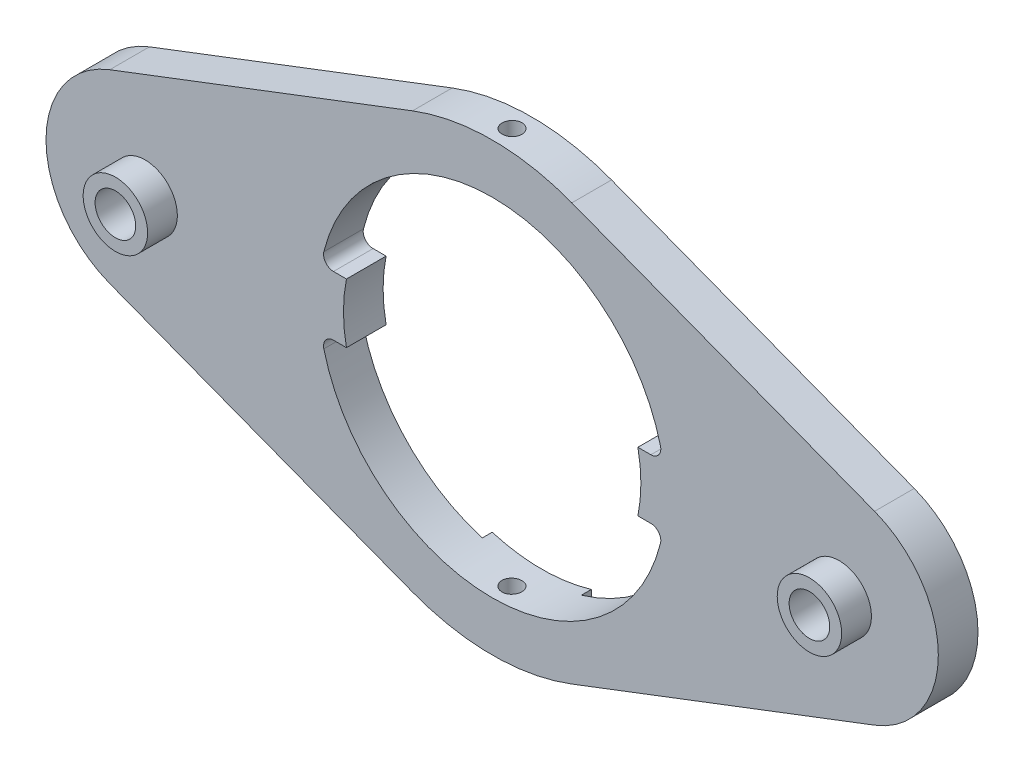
SolidWorks part; units mm, degrees
ref_plane "前视基准面" through (0, 0, 0) normal (0, 0, 1) x (1, 0, 0)
ref_plane "上视基准面" through (0, 0, 0) normal (0, 1, 0) x (1, 0, 0)
ref_plane "右视基准面" through (0, 0, 0) normal (1, 0, 0) x (0, 0, -1)
sketch "草图1" plane through (0, 0, 0) normal (0, 0, 1) x (1, 0, 0)
  line L0 (-8.0357, 21.0161) -> (-38.5714, 9.3405)
  line L1 (0, 0) -> (0, 51.632) construction
  line L2 (-38.5714, -9.3405) -> (-8.0357, -21.0161)
  line L3 (0, 0) -> (-33.8264, 0) construction
  line L4 (38.5714, -9.3405) -> (8.0357, -21.0161)
  line L5 (8.0357, 21.0161) -> (38.5714, 9.3405)
  circle A0 centre (0, 0) radius 17.5
  arc A1 (-8.0357, -21.0161) -> (8.0357, -21.0161) centre (0, 0) ccw
  arc A2 (-38.5714, 9.3405) -> (-38.5714, -9.3405) centre (-35, 0) ccw
  arc A3 (38.5714, 9.3405) -> (38.5714, -9.3405) centre (35, 0) cw
  arc A4 (8.0357, 21.0161) -> (-8.0357, 21.0161) centre (0, 0) ccw
  dimension "D1" = 35
  dimension "D2" = 45
  dimension "D4" = 10
  dimension "D3" = 70
extrude "凸台-拉伸1" add sketch "草图1" along normal mid plane 4
sketch "草图2" plane through (0, 0, 2) normal (0, 0, 1) x (1, 0, 0)
  line L0 (0, 0) -> (0, 12.2881) construction
  circle A0 centre (-35, 0) radius 1.45
  circle A1 centre (35, 0) radius 1.45
  dimension "D1" = 2.9
  dimension "D2" = 70
hole_wizard "M4 螺纹孔1" positions "3D草图1" profile "草图3" tap size "M4" standard "GB"
sketch3d "3D草图1"
  point P0 (-35, 0, 2)
  point P3 (35, 0, 2)
sketch "草图3" plane through (-35, 0, 2) normal (1, 0, 0) x (0, -1, 0)
  line L0 (0, 0) -> (0, 4)
  line L1 (0, 4) -> (1.65, 4)
  line L2 (1.65, 4) -> (1.65, 0)
  line L5 (1.65, 0) -> (0, 0)
  line L11 (0, -6.35) -> (0, 107.95) construction
  dimension "通孔螺纹孔钻头直径" = 3.3
  dimension "通孔螺纹孔钻头深度" = 4
sketch "草图4" plane through (0, 0, 2) normal (0, 0, 1) x (1, 0, 0)
  line L0 (0, 0) -> (-26.4337, 0) construction
sketch "草图5" plane through (0, 0, 2) normal (0, 0, 1) x (1, 0, 0)
  line L0 (14.6969, 3) -> (18, 3)
  line L1 (-18, 3) -> (-14.6969, 3)
  line L2 (-18, 3) -> (-18, -3)
  line L3 (-18, -3) -> (-14.6969, -3)
  line L4 (18, 3) -> (18, -3)
  line L5 (-18, 3) -> (18, -3) construction
  line L6 (-18, -3) -> (18, 3) construction
  line L7 (14.6969, -3) -> (18, -3)
  arc A0 (-14.6969, 3) -> (-14.6969, -3) centre (0, 0) ccw
  arc A1 (14.6969, -3) -> (14.6969, 3) centre (0, 0) ccw
  point P3 (0, 0)
  dimension "D1" = 30
  dimension "D2" = 36
  dimension "D3" = 6
extrude "凸台-拉伸2" add sketch "草图5" against normal blind 4
fillet "圆角1" radius 1 4 edges at (-17.2409, 3, 0) (-17.2409, -3, 0) (17.2409, 3, 0) (17.2409, -3, 0)
ref_plane "基准面1" through (0, 22.5, 0) normal (0, 1, 0) x (1, 0, 0)
sketch "草图6" plane through (0, 22.5, 0) normal (0, 1, 0) x (1, 0, 0)
  circle A0 centre (0, 0) radius 1
  dimension "D1" = 2
ref_plane "基准面4" through (0, -22.5, 0) normal (0, 1, 0) x (1, 0, 0)
extrude "切除-拉伸1" cut sketch "草图6" against normal blind 52
sketch "草图7" plane through (0, 0, 2) normal (0, 0, 1) x (1, 0, 0)
  line L0 (0, 0) -> (0, 30.1855) construction
  circle A0 centre (-35, 0) radius 2.05
  circle A1 centre (-35, 0) radius 3.25
  circle A2 centre (35, 0) radius 2.05
  circle A3 centre (35, 0) radius 3.25
  dimension "D1" = 4.1
  dimension "D2" = 6.5
extrude "凸台-拉伸3" add sketch "草图7" along normal blind 3
sketch "草图8" plane through (0, 0, -2) normal (0, 0, -1) x (-1, 0, 0)
  line L0 (0, 17.5) -> (0, 19.5) construction
  line L1 (-5, 18.8481) -> (-5, 16.7705)
  line L2 (5, 18.8481) -> (5, 16.7705)
  line L3 (5, -16.7705) -> (5, -18.8481)
  line L4 (-5, -16.7705) -> (-5, -18.8481)
  arc A0 (5, 16.7705) -> (-5, 16.7705) centre (0, 0) ccw
  arc A1 (5, 18.8481) -> (-5, 18.8481) centre (0, 0) ccw
  arc A2 (-5, -18.8481) -> (5, -18.8481) centre (0, 0) ccw
  arc A3 (-5, -16.7705) -> (5, -16.7705) centre (0, 0) ccw
  dimension "D1" = 2
  dimension "D2" = 5
  dimension "D3" = 5
extrude "凸台-拉伸4" add sketch "草图8" along normal blind 1
